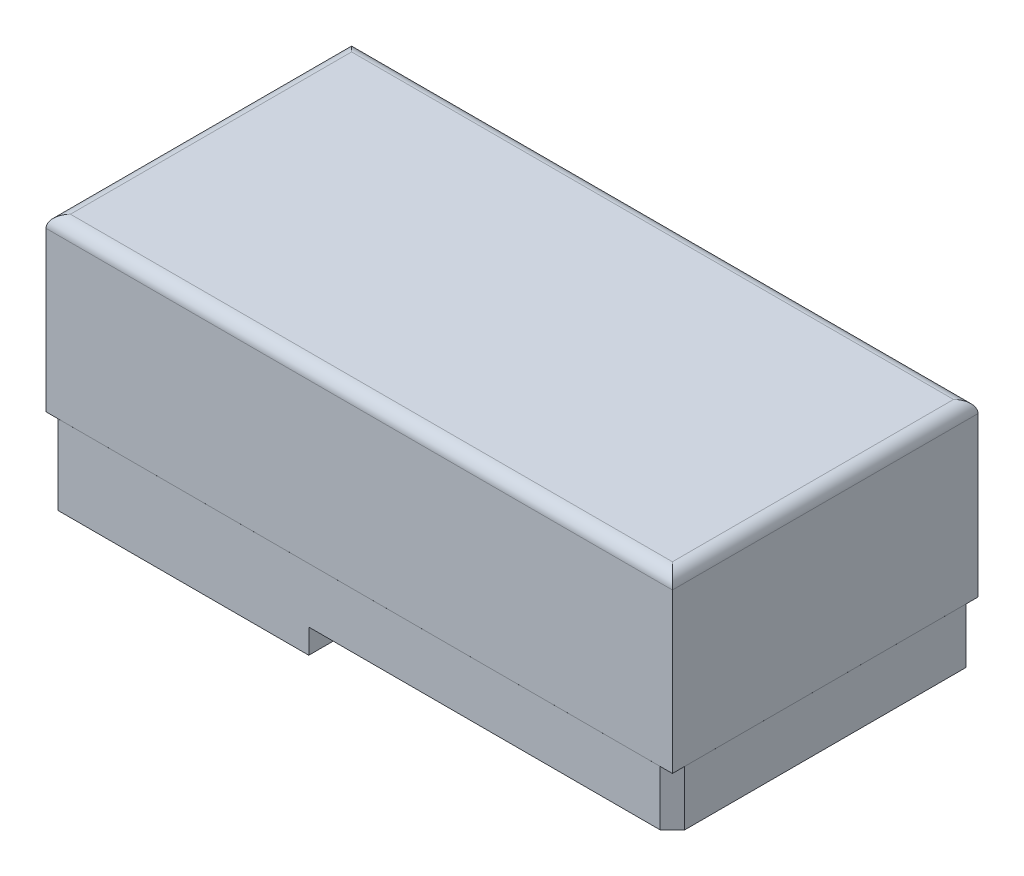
SolidWorks part; units mm, degrees
ref_plane "前视基准面" through (0, 0, 0) normal (0, 0, 1) x (1, 0, 0)
ref_plane "上视基准面" through (0, 0, 0) normal (0, 1, 0) x (1, 0, 0)
ref_plane "右视基准面" through (0, 0, 0) normal (1, 0, 0) x (0, 0, -1)
sketch "草图1" plane through (0, 0, 0) normal (0, 0, 1) x (1, 0, 0)
  line L0 (-89.0332, -4) -> (-89.0332, 8)
  line L1 (-89.0332, 8) -> (13.4668, 8)
  line L2 (13.4668, 8) -> (13.4668, 0)
  line L3 (13.4668, 0) -> (-46.0332, 0)
  line L4 (-46.0332, 0) -> (-46.0332, -4)
  line L5 (-46.0332, -4) -> (-89.0332, -4)
  dimension "D1" = 102.5
  dimension "D2" = 8
  dimension "D3" = 4
  dimension "D4" = 43
extrude "凸台-拉伸1" add sketch "草图1" along normal mid plane 50
sketch "草图2" plane through (0, 8, 0) normal (0, 1, 0) x (1, 0, 0)
  line L0 (-89.0332, -25) -> (-89.0332, 25) construction
  circle A0 centre (-68.0332, 0) radius 8
  dimension "D1" = 21
  dimension "D2" = 16
extrude "切除-拉伸1" cut sketch "草图2" against normal through all
sketch "草图5" plane through (0, 8, 0) normal (0, 1, 0) x (1, 0, 0)
  line L0 (-14.5332, 0) -> (-4.5332, 0) construction
  line L1 (-14.5332, 5) -> (-4.5332, 5)
  line L2 (-14.5332, -5) -> (-4.5332, -5)
  line L9 (-36.0311, 0) -> (16.1407, 0) construction
  arc A0 (-14.5332, 5) -> (-14.5332, -5) centre (-14.5332, 0) ccw
  arc A1 (-4.5332, -5) -> (-4.5332, 5) centre (-4.5332, 0) ccw
  circle A2 centre (-68.0332, 0) radius 8 construction
  circle A3 centre (-68.0332, 0) radius 8
  point P3 (-9.5332, 0)
  dimension "D1" = 5
  dimension "D2" = 10
  dimension "D3" = 58.5
extrude "切除-拉伸2" cut sketch "草图5" against normal through all
sketch "草图6" plane through (0, 8, 0) normal (0, 1, 0) x (1, 0, 0)
  line L8 (13.4668, 25) -> (-89.0332, 25)
  line L10 (-89.0332, 25) -> (-89.0332, -25)
  line L12 (-89.0332, -25) -> (13.4668, -25)
  line L14 (13.4668, -25) -> (13.4668, 25)
  line L16 (13.4668, 25) -> (-89.0332, 25)
  line L18 (-89.0332, 25) -> (-89.0332, -25)
  line L20 (-89.0332, -25) -> (13.4668, -25)
  line L22 (13.4668, -25) -> (13.4668, 25)
  dimension "D1" = 0
extrude "凸台-拉伸2" add sketch "草图6" along normal blind 29
ref_plane "基准面1" through (0, 9, 0) normal (0, -1, 0) x (-1, 0, 0)
sketch "草图7" plane through (0, 9, 0) normal (0, -1, 0) x (-1, 0, 0)
  line L1 (-15.6952, 26.1087) -> (95.9889, 26.1087)
  line L2 (-15.6952, 26.1087) -> (-15.6952, -27.5812)
  line L3 (-15.6952, -27.5812) -> (95.9889, -27.5812)
  line L4 (95.9889, 26.1087) -> (95.9889, -27.5812)
extrude "切除-拉伸3" cut sketch "草图7" against normal blind 0.001
fillet "圆角1" radius 2 4 edges at (-89.0332, 37, 0) (-37.7832, 37, 25) (13.4668, 37, 0) (-37.7832, 37, -25)
chamfer "倒角1" distance 2 angle 45 4 edges at (13.4668, 4.5, -25) (-89.0332, 2.5, -25) (13.4668, 4.5, 25) (-89.0332, 2.5, 25)
